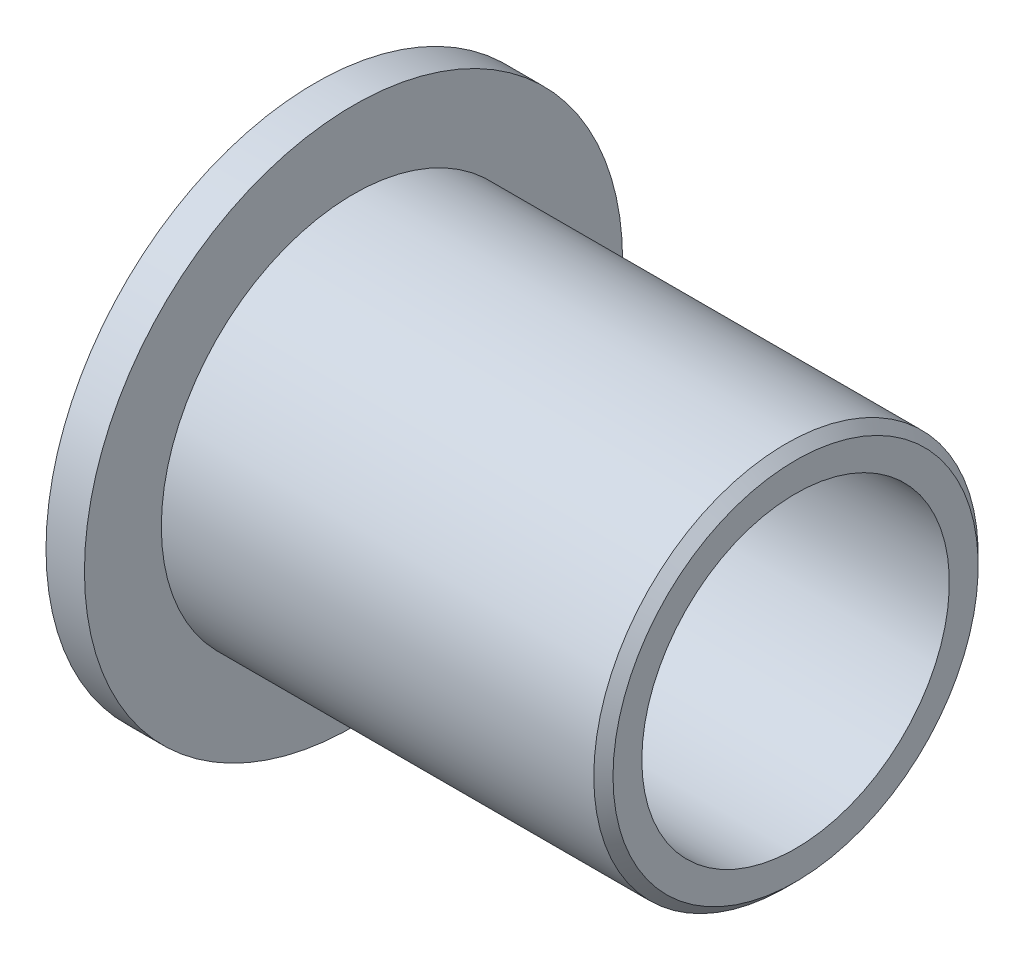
SolidWorks part; units mm, degrees
ref_plane "Plan de face" through (0, 0, 0) normal (0, 0, 1) x (1, 0, 0)
ref_plane "Plan de dessus" through (0, 0, 0) normal (0, 1, 0) x (1, 0, 0)
ref_plane "Plan de droite" through (0, 0, 0) normal (1, 0, 0) x (0, 0, -1)
sketch "Esquisse1" plane through (0, 0, 0) normal (0, 0, 1) x (1, 0, 0)
  line L0 (0, 0) -> (70.3477, 0) construction
  line L1 (0, 14) -> (2, 14)
  line L2 (0, 14) -> (0, 8)
  line L3 (0, 8) -> (25, 8)
  line L4 (25, 10) -> (25, 8)
  line L5 (2, 14) -> (2, 10)
  line L6 (2, 10) -> (25, 10)
  dimension "D1" = 25
  dimension "D2" = 8
  dimension "D3" = 2
  dimension "D4" = 14
  dimension "D5" = 2
revolve "Révolution1" add sketch "Esquisse1" angle 360 about L0
chamfer "Chanfrein1" distance 0.5 angle 45 1 edges at (25, 0, 10)
